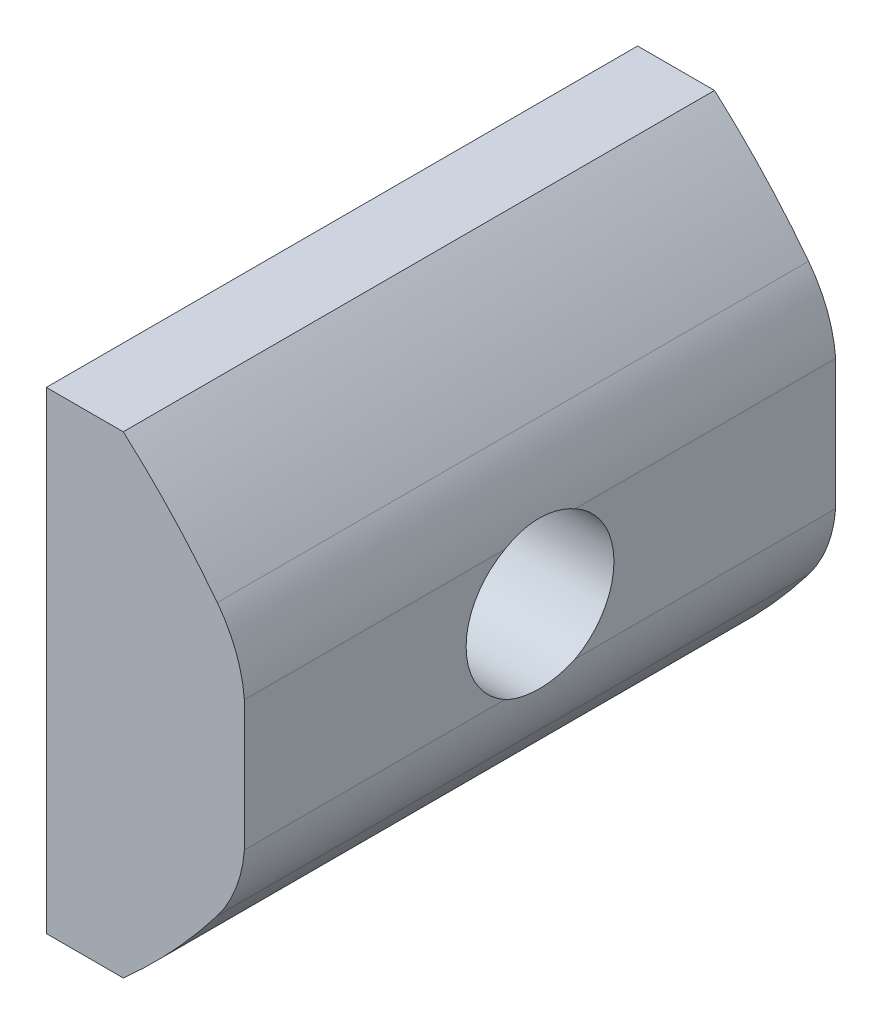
SolidWorks part; units mm, degrees
ref_plane "Face" through (0, 0, 0) normal (0, 0, 1) x (1, 0, 0)
ref_plane "Dessus" through (0, 0, 0) normal (0, 1, 0) x (1, 0, 0)
ref_plane "Droite" through (0, 0, 0) normal (1, 0, 0) x (0, 0, -1)
sketch "Esquisse1" plane through (0, 0, 0) normal (0, 0, 1) x (1, 0, 0)
  line L0 (4, 2.2) -> (4, -2.2)
  line L1 (-3, 8) -> (-3, -8)
  line L2 (-3, 8) -> (-0.0973, 8)
  line L3 (-13.2281, 0) -> (13.0623, 0) construction
  line L4 (-3, -8) -> (-0.0973, -8)
  arc A0 (3.0833, -4.5866) -> (-0.0973, -8) centre (-16.35, 10.3331) cw
  arc A1 (4, -2.2) -> (3.0833, -4.5866) centre (-0.4861, -1.8463) cw
  arc A2 (4, 2.2) -> (3.0833, 4.5866) centre (-0.4861, 1.8463) ccw
  arc A3 (3.0833, 4.5866) -> (-0.0973, 8) centre (-16.35, -10.3331) ccw
  point P6 (4, 0)
  point P14 (-3, 0)
  dimension "D2" = 4.5
  dimension "D3" = 8
  dimension "D1" = 4
  dimension "D6" = 7
  dimension "D8" = 2.2
extrude "Extrusion1" add sketch "Esquisse1" along normal mid plane 20
chamfer "Chanfrein1" distance 0.3 angle 45
hole_wizard "Trou taraudé M6x1.01" positions "Esquisse5" profile "Esquisse4" tap size "M6x1.0" standard "ISO"
sketch "Esquisse5" plane through (-3, 0, 0) normal (-1, 0, 0) x (0, 0, 1)
  point P0 (0, 0)
sketch "Esquisse4" plane through (-3, 0, 0) normal (0, 1, 0) x (0, 0, 1)
  line L0 (0, 0) -> (0, 7)
  line L1 (0, 7) -> (2.5, 7)
  line L2 (2.5, 7) -> (2.5, 0)
  line L5 (2.5, 0) -> (0, 0)
  line L11 (0, -6.35) -> (0, 107.95) construction
  dimension "Diamètre du trou pour taraudage jusqu'au prochain" = 5
  dimension "Profondeur du trou pour taraudage jusqu'au prochain" = 7
